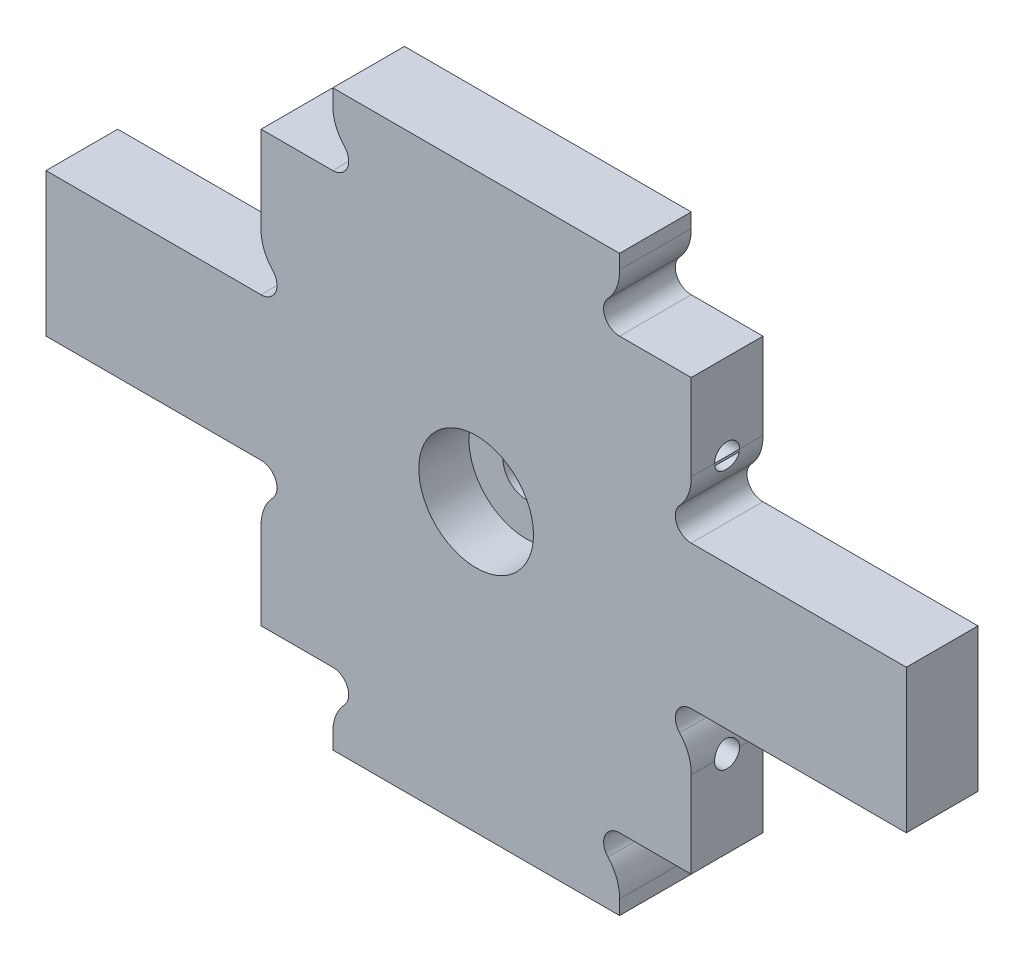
SolidWorks part; units mm, degrees
ref_plane "Plan de face" through (0, 0, 0) normal (0, 0, 1) x (1, 0, 0)
ref_plane "Plan de dessus" through (0, 0, 0) normal (0, 1, 0) x (1, 0, 0)
ref_plane "Plan de droite" through (0, 0, 0) normal (1, 0, 0) x (0, 0, -1)
sketch "Esquisse1" plane through (0, 0, 0) normal (0, 0, 1) x (1, 0, 0)
  line L6 (30, -10) -> (60, -10)
  line L7 (60, -10) -> (60, 10)
  line L8 (60, 10) -> (30, 10)
  line L10 (30, 30) -> (-30, 30)
  line L11 (-30, 30) -> (-30, 18)
  line L12 (-30, 10) -> (-60, 10)
  line L13 (-60, 10) -> (-60, -10)
  line L14 (-60, -10) -> (-30, -10)
  line L15 (-29.9978, -18) -> (-29.9978, -30)
  line L16 (-29.9978, -30) -> (29.9978, -30)
  line L17 (29.9978, -30) -> (29.9978, -18)
  line L18 (0, -55) -> (0, 55) construction
  line L19 (30, 30) -> (30, 18)
  arc A0 (29.9978, -18) -> (28.3796, -13.7374) centre (24, -17.8386) ccw
  arc A1 (30, -10) -> (28.3796, -13.7374) centre (30, -12.22) ccw
  arc A4 (-30, 18) -> (-28.3796, 13.7374) centre (-24.0021, 17.8408) ccw
  arc A5 (-30, 10) -> (-28.3796, 13.7374) centre (-30, 12.22) ccw
  arc A6 (-28.3796, -13.7374) -> (-30, -10) centre (-30, -12.22) ccw
  arc A7 (-28.3796, -13.7374) -> (-29.9978, -18) centre (-24, -17.8386) ccw
  arc A8 (30, 10) -> (28.3796, 13.7374) centre (30, 12.22) cw
  arc A9 (30, 18) -> (28.3796, 13.7374) centre (24.0021, 17.8408) cw
  dimension "D1" = 60
  dimension "D2" = 20
  dimension "D3" = 20
  dimension "D4" = 30
  dimension "D5" = 12
  dimension "D6" = 30
  dimension "D7" = 10
  dimension "D8" = 10
  dimension "D9" = 12
  dimension "D10" = 12
  dimension "D11" = 30
  dimension "D12" = 30
extrude "Boss.-Extru.1" add sketch "Esquisse1" along normal blind 10
sketch "Esquisse2" plane through (0, 0, 10) normal (0, 0, 1) x (1, 0, 0)
  circle A0 centre (0, 0) radius 3.25
  dimension "D1" = 6.5
extrude "Enlèv. mat.-Extru.1" cut sketch "Esquisse2" against normal blind 10
sketch "Esquisse3" plane through (0, 0, 10) normal (0, 0, 1) x (1, 0, 0)
  circle A0 centre (0, 0) radius 8
  dimension "D1" = 16
extrude "Enlèv. mat.-Extru.2" cut sketch "Esquisse3" against normal blind 7
hole_wizard "Diamètre du perçage Ø3.5 (3.5)1" positions "Esquisse6" profile "Esquisse7" hole size "Ø3.5" standard "ISO"
sketch "Esquisse6" plane through (30, 0, 0) normal (1, 0, 0) x (0, 0, -1)
  line L5 (0, -30) -> (0, -18) construction
  point P0 (-5, 18)
  point P2 (-5, -18)
  dimension "D1" = 18
  dimension "D2" = 18
  dimension "D3" = 5
  dimension "D4" = 5
sketch "Esquisse7" plane through (30, 18, 5) normal (0, 1, 0) x (0, 0, -1)
  line L0 (0, 0) -> (0, 15.0515)
  line L1 (0, 15.0515) -> (1.75, 14)
  line L2 (1.75, 14) -> (1.75, 0)
  line L5 (1.75, 0) -> (0, 0)
  line L10 (0, 15.0515) -> (-1.75, 14) construction
  line L11 (0, -6.35) -> (0, 107.95) construction
  dimension "Diamètre du perçage" = 3.5
  dimension "Profondeur du perçage" = 14
  dimension "Angle de pointe" = 118
mirror "Symétrie1" about plane through (0, 0, 0) normal (1, 0, 0) of "Diamètre du perçage Ø3.5 (3.5)1"
sketch "Esquisse8" plane through (0, 0, 10) normal (0, 0, 1) x (1, 0, 0)
  line L0 (30, 30) -> (-30, 30) construction
  line L2 (-20, 38) -> (-20, 40)
  line L3 (0, -5.5) -> (0, 5.5) construction
  line L4 (20, 38) -> (20, 40)
  line L5 (-20, 40) -> (20, 40)
  line L7 (-20, 30) -> (20, 30)
  arc A0 (-20, 38) -> (-18.3801, 33.738) centre (-14.0021, 37.8408) ccw
  arc A1 (-20, 30) -> (-18.3801, 33.738) centre (-20, 32.22) ccw
  arc A2 (20, 30) -> (18.3801, 33.738) centre (20, 32.22) cw
  arc A3 (20, 38) -> (18.3801, 33.738) centre (14.0021, 37.8408) cw
  dimension "D1" = 2.22
  dimension "D2" = 6
  dimension "D3" = 10
  dimension "D4" = 20
  dimension "D5" = 8
extrude "Boss.-Extru.2" add sketch "Esquisse8" against normal blind 10
mirror "Symétrie2" about plane through (0, 0, 0) normal (0, 1, 0) of "Boss.-Extru.2"
